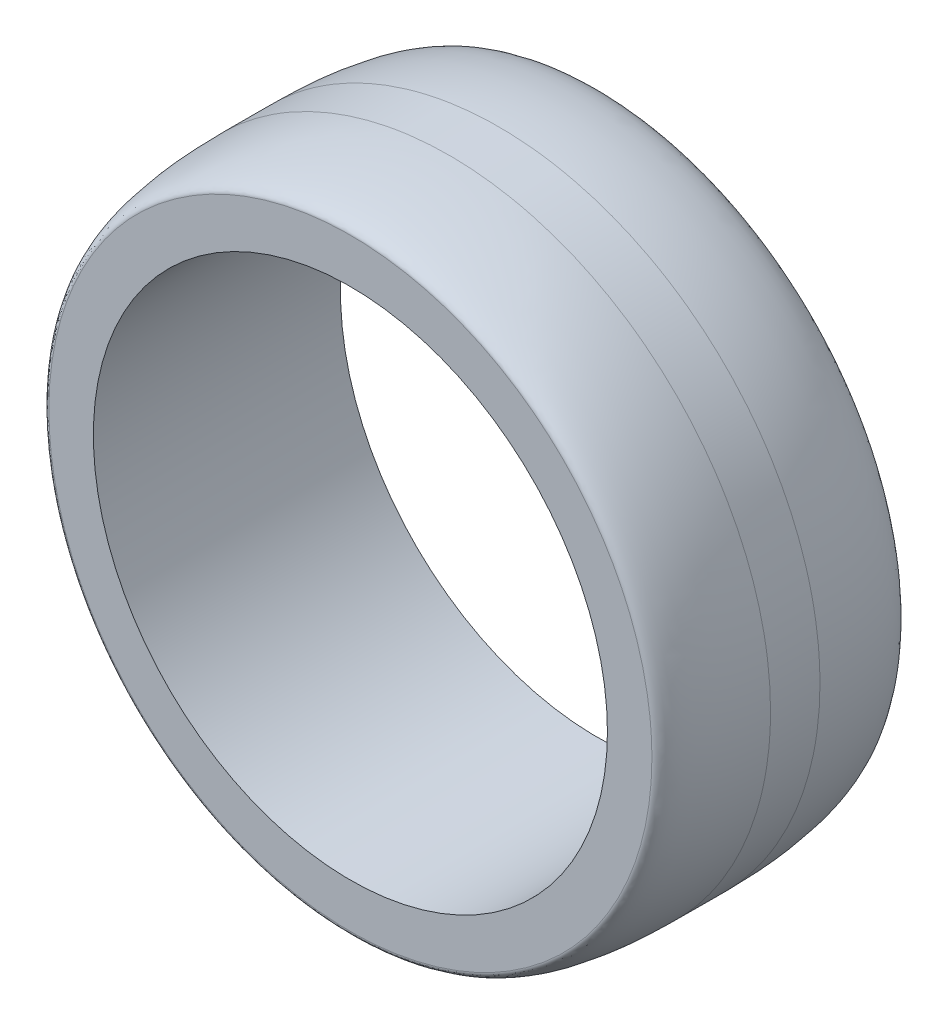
SolidWorks part; units mm, degrees
ref_plane "Front Plane" through (0, 0, 0) normal (0, 0, 1) x (1, 0, 0)
ref_plane "Top Plane" through (0, 0, 0) normal (0, 1, 0) x (1, 0, 0)
ref_plane "Right Plane" through (0, 0, 0) normal (1, 0, 0) x (0, 0, -1)
sketch "Sketch2" plane through (0, 0, 0) normal (0, 0, 1) x (1, 0, 0)
  circle A1 centre (-63.6221, -6.2963) radius 26
  circle A2 centre (-63.6221, -6.2963) radius 32.5
  dimension "D1" = 65
extrude "Boss-Extrude1" add sketch "Sketch2" against normal up to surface (25 mm away)
fillet "Fillet1" radius 10 2 edges at (-31.1221, -6.2963, -25) (-31.1221, -6.2963, 0)
